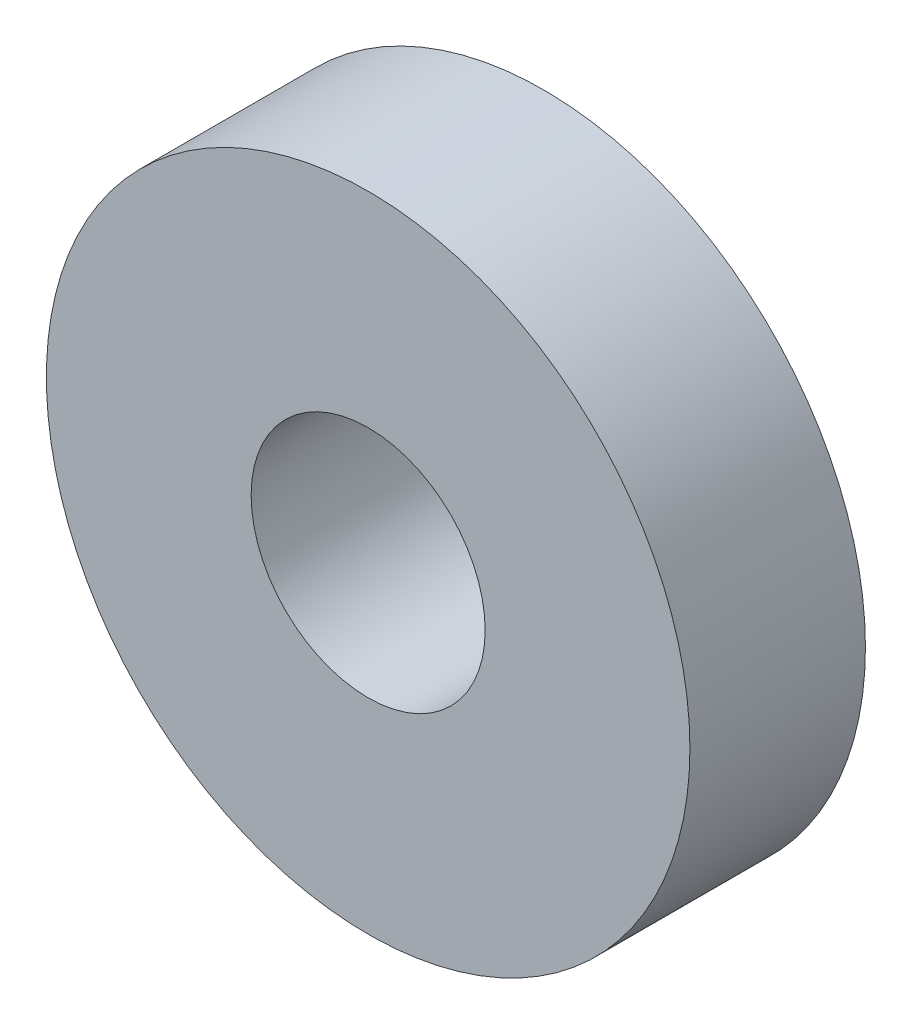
SolidWorks part; units mm, degrees
ref_plane "Plan de face" through (0, 0, 0) normal (0, 0, 1) x (1, 0, 0)
ref_plane "Plan de dessus" through (0, 0, 0) normal (0, 1, 0) x (1, 0, 0)
ref_plane "Plan de droite" through (0, 0, 0) normal (1, 0, 0) x (0, 0, -1)
sketch "Esquisse1" plane through (0, 0, 0) normal (0, 0, 1) x (1, 0, 0)
  circle A0 centre (0, 0) radius 11
  circle A1 centre (0, 0) radius 4
  dimension "D1" = 22
  dimension "D2" = 8
extrude "Boss.-Extru.1" add sketch "Esquisse1" along normal blind 6
